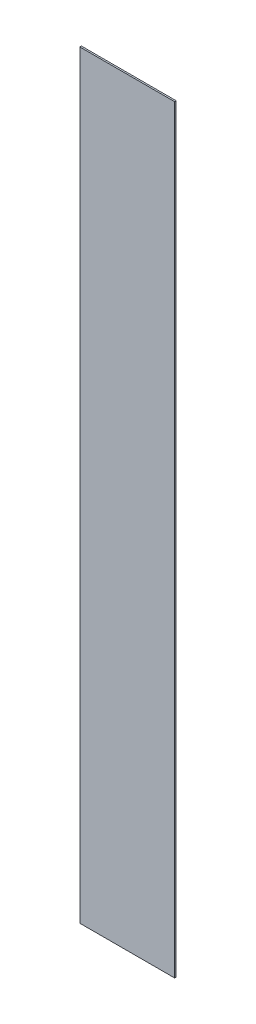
SolidWorks part; units mm, degrees
ref_plane "Plan de face" through (0, 0, 0) normal (0, 0, 1) x (1, 0, 0)
ref_plane "Plan de dessus" through (0, 0, 0) normal (0, 1, 0) x (1, 0, 0)
ref_plane "Plan de droite" through (0, 0, 0) normal (1, 0, 0) x (0, 0, -1)
sketch "EW_SKETCH" plane through (0, 0, 0) normal (0, 1, 0) x (1, 0, 0)
  line L0 (-30, 0) -> (30, 0)
  line L1 (30, 0) -> (30, -1)
  line L2 (30, -1) -> (-30, -1)
  line L3 (-30, -1) -> (-30, 0)
extrude "EW_EXTRUDE" add sketch "EW_SKETCH" along normal blind 480
equation "\"th_duct@EW_SKETCH\"=1"
